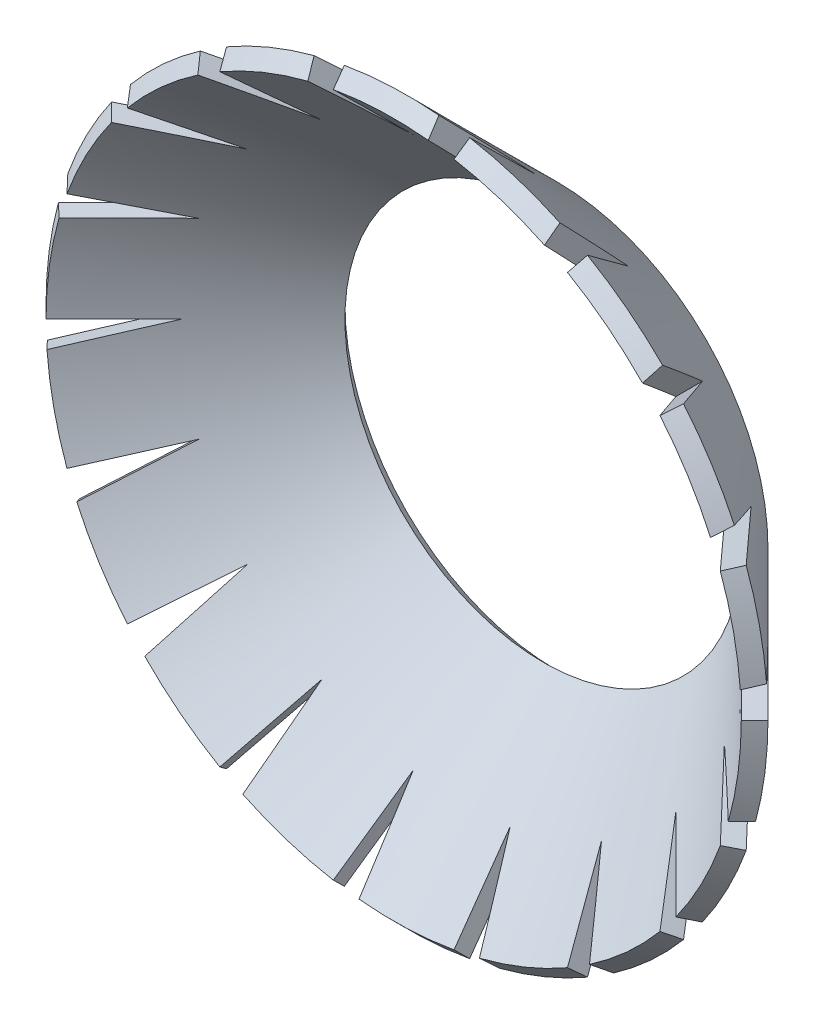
SolidWorks part; units mm, degrees
ref_plane "Front Plane" through (0, 0, 0) normal (0, 0, 1) x (1, 0, 0)
ref_plane "Top Plane" through (0, 0, 0) normal (0, 1, 0) x (1, 0, 0)
ref_plane "Right Plane" through (0, 0, 0) normal (1, 0, 0) x (0, 0, -1)
other "Configuration Table"
sketch "BodySke" plane through (0, 0, 0) normal (0, 1, 0) x (1, 0, 0)
  line L0 (0, -1.6) -> (0, 3.997) construction
  line L1 (0, 0) -> (7.65, 0) construction
  line L2 (7.65, 0) -> (5.2387, 2.4113) construction
  line L3 (7.65, 0) -> (4.4828, 3.1672)
  line L4 (7.65, 0) -> (7.3672, -0.2828)
  line L5 (7.3672, -0.2828) -> (4.2, 2.8843)
  line L6 (4.2, 2.8843) -> (4.4828, 3.1672)
  line L7 (0, 0) -> (-18, 0) construction
revolve "BaseBody" add sketch "BodySke" angle 360 about L0
sketch "ToothSke" plane through (0, 0, 0) normal (0, 0, 1) x (1, 0, 0)
  line L0 (0, 0) -> (4.8783, 0) construction
  line L1 (7.65, 0) -> (7.65, 0.6676)
  line L2 (7.65, -0.6676) -> (7.65, 0.6676) construction
  line L4 (5.925, 0) -> (7.65, 0.6676)
  line L5 (5.925, 0) -> (7.65, 0)
  circle A0 centre (0, 0) radius 7.65 construction
  circle A1 centre (0, 0) radius 7.65 construction
  arc A2 (-5.925, 0) -> (5.9026, 0.5147) centre (0, 0) ccw construction
  point P9 (7.65, 0)
extrude "ToothCut" cut sketch "ToothSke" against normal through all and the other way through all
pattern_circular "ToothPat" count 18 over 360 about axis through (0, 0, 0) along (0, 0, 1) of "ToothCut"
equation "\"D1@ToothSke\" =  ( \"Outer_dia@BodySke\" + \"Inner_dia@BodySke\" )  / 2"
equation "\"D2@ToothSke\" = pi  * \"Outer_dia@BodySke\" / 2 / \"Num_tooth@BodySke\""
equation "\"Num_tooth@ToothPat\" = \"Num_tooth@BodySke\""
